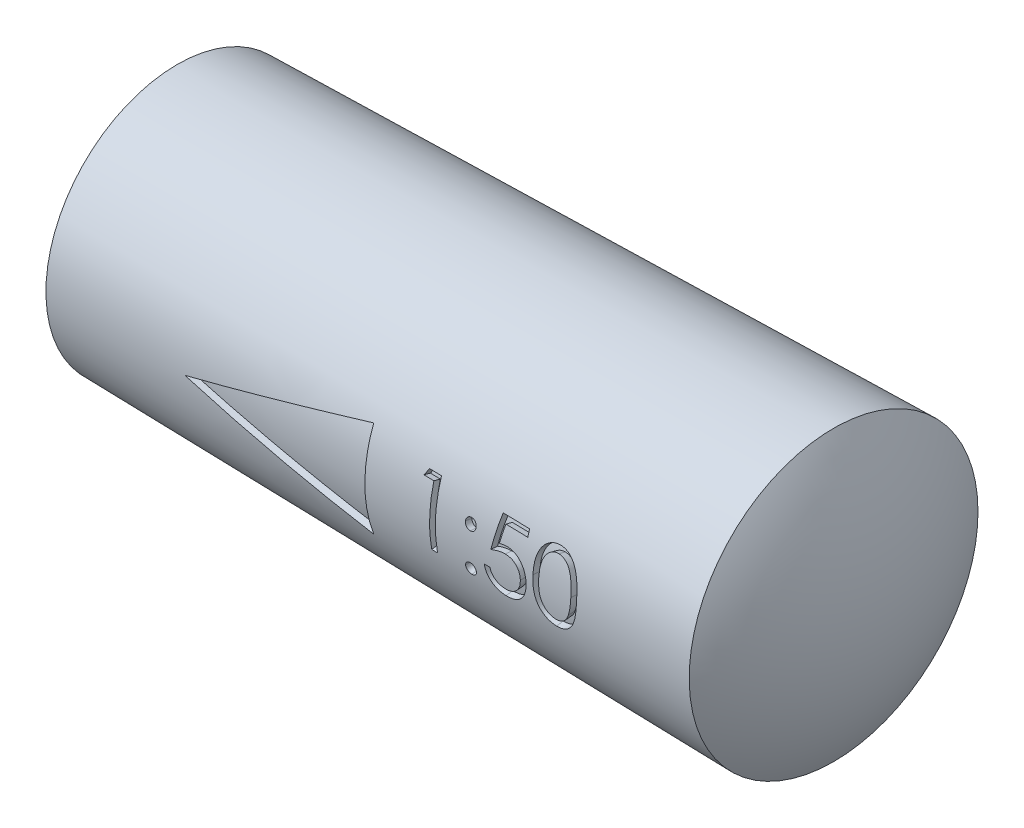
SolidWorks part; units mm, degrees
ref_plane "Front Plane" through (0, 0, 0) normal (0, 0, 1) x (1, 0, 0)
ref_plane "Top Plane" through (0, 0, 0) normal (0, 1, 0) x (1, 0, 0)
ref_plane "Right Plane" through (0, 0, 0) normal (1, 0, 0) x (0, 0, -1)
sketch "Sketch1" plane through (0, 0, 0) normal (1, 0, 0) x (0, 0, -1)
  circle A0 centre (0, 0) radius 2
  dimension "D1" = 4
extrude "Extrude1" add sketch "Sketch1" along normal mid plane 10
draft "Draft1" type of draft neutral plane draft angle 1.146 faces to draft 1 parameters "D1"=1.146
sketch "Sketch2" plane through (0, 0, 0) normal (0, 0, 1) x (1, 0, 0)
  line L0 (-5, 0) -> (-5, 2)
  line L1 (-5, 2) -> (-5, -2) construction
  line L2 (-5, 0) -> (-5.6, 0)
  line L3 (-5.6, 0) -> (-5.6, -2.1) construction
  line L4 (5, 0) -> (5, 2.2)
  line L5 (5, -2.2) -> (5, 2.2) construction
  line L6 (5, 0) -> (5.6, 0)
  line L7 (5.6, 0) -> (5.6, -2.1) construction
  line L8 (-5, -2) -> (5, -2.2) construction
  arc A0 (-5.6, 0) -> (-5, 2) centre (-1.9667, 0) cw
  arc A1 (5.6, 0) -> (5, 2.2) centre (1.2666, 0) ccw
  point P14 (0, -2.1)
revolve "Revolve1" add sketch "Sketch2" angle 360 about L2
sketch "Sketch5" plane through (0, 0, 0) normal (0, 0, 1) x (1, 0, 0)
  line L0 (0, 2.1) -> (0, -2.1) construction
  line L1 (5, 2.2) -> (-5, 2) construction
  line L2 (-5, -2) -> (5, -2.2) construction
ref_plane "Plane2" through (0, 0, 0) normal (-0.02, 0, 0.9998) x (0.9998, 0, 0.02)
sketch "Sketch6" plane through (0, 0, 0) normal (-0.02, 0, 0.9998) x (0.9998, 0, 0.02)
  line L0 (0, 0) -> (0, 0.75)
  line L1 (0, 2.1) -> (0, -2.1) construction
  line L2 (0, 0.75) -> (-2.799, 0)
  line L3 (-2.799, 0) -> (0, -0.75)
  line L4 (0, -0.75) -> (0, 0)
  line L5 (0, -0.375) -> (4, -0.375) construction
  text T0 "1:50" font "Century Gothic" height 1
  dimension "D1" = 1.5
  dimension "D2" = 30
  dimension "D3" = 4
wrap "Wrap2" sketch "Sketch6" wrap type deboss source sketch "Sketch6" thickness 0.1 parameters "D1"=0.1
equation "\"D2@Sketch2\" = \"D1@Sketch2\""
